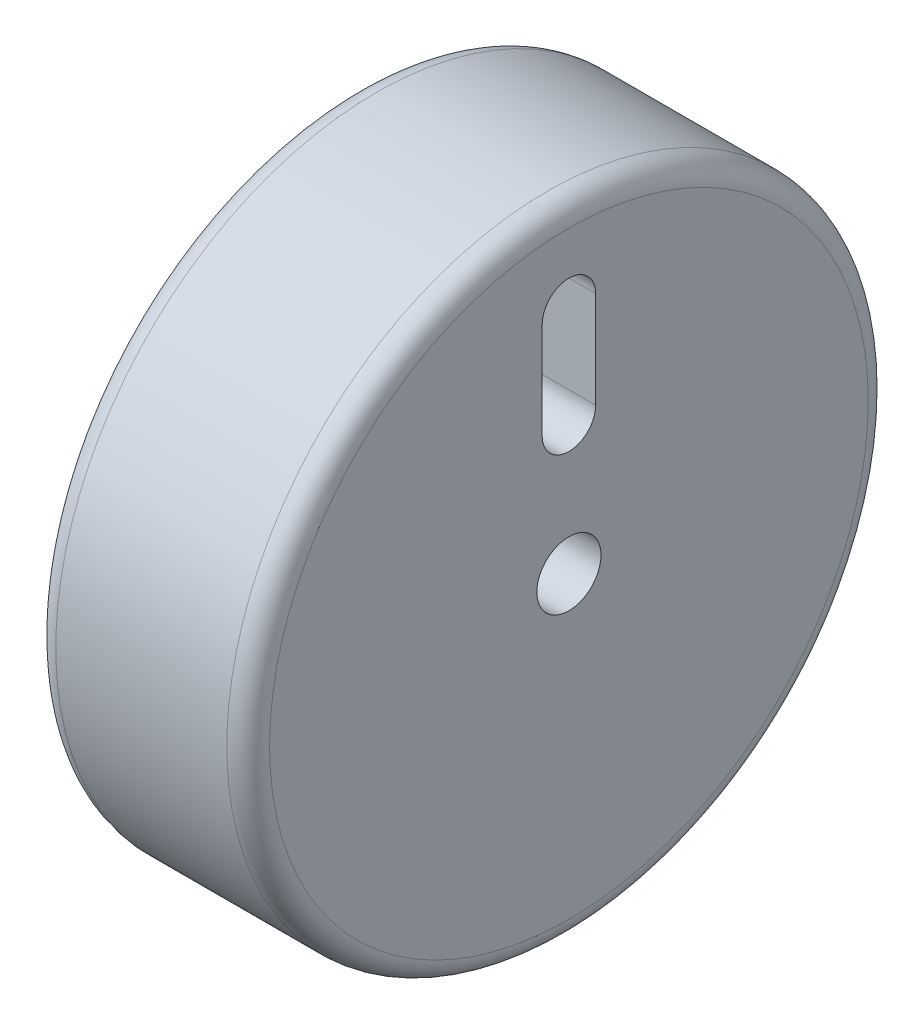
SolidWorks part; units mm, degrees
ref_plane "Vorderseite" through (0, 0, 0) normal (0, 0, 1) x (1, 0, 0)
ref_plane "Oben" through (0, 0, 0) normal (0, 1, 0) x (1, 0, 0)
ref_plane "Rechts" through (0, 0, 0) normal (1, 0, 0) x (0, 0, -1)
sketch "Skizze1" plane through (0, 0, 0) normal (0, 0, 1) x (1, 0, 0)
  line L0 (0, -50) -> (0, 50) construction
  line L3 (-40, 300) -> (40, 300)
  line L5 (-49.774, 0.678) -> (50, 300) construction
  line L6 (-50, 300) -> (50, 0) construction
  line L8 (-50, 165) -> (-50, 290)
  line L11 (-50, 165) -> (50, 165)
  line L13 (-52.158, 134.3526) -> (50, 165) construction
  line L14 (-50, 165) -> (47.0092, 135.8972) construction
  line L15 (50, 165) -> (50, 290)
  line L16 (0, 150) -> (-76.0575, 150) construction
  line L17 (50, 0) -> (-50, 0) construction
  arc A0 (40, 300) -> (50, 290) centre (40, 290) cw
  arc A1 (-50, 290) -> (-40, 300) centre (-40, 290) cw
  arc A2 (50, 250) -> (-50, 250) centre (0, 250) ccw construction
  point P0 (0, 150)
  point P10 (0, 150)
  point P16 (0, 165)
  dimension "D6" = 10
  dimension "D1" = 100
  dimension "D2" = 300
  dimension "D3" = 150
  dimension "D4" = 15
  dimension "D5" = 135
revolve "Rotation1" add sketch "Skizze1" angle 360 about L16
sketch "Skizze2" plane through (50, 0, 0) normal (1, 0, 0) x (0, 0, -1)
  line L0 (0, 212.0018) -> (0, 257.2171) construction
  line L1 (0, 165) -> (0, 290) construction
  line L2 (-12.5, 212.0018) -> (-12.5, 257.2171)
  line L3 (12.5, 212.0018) -> (12.5, 257.2171)
  arc A0 (-12.5, 212.0018) -> (12.5, 212.0018) centre (0, 212.0018) ccw
  arc A1 (12.5, 257.2171) -> (-12.5, 257.2171) centre (0, 257.2171) ccw
  point P4 (0, 234.6095)
extrude "Schnitt-Linear austragen1" cut sketch "Skizze2" against normal through all
